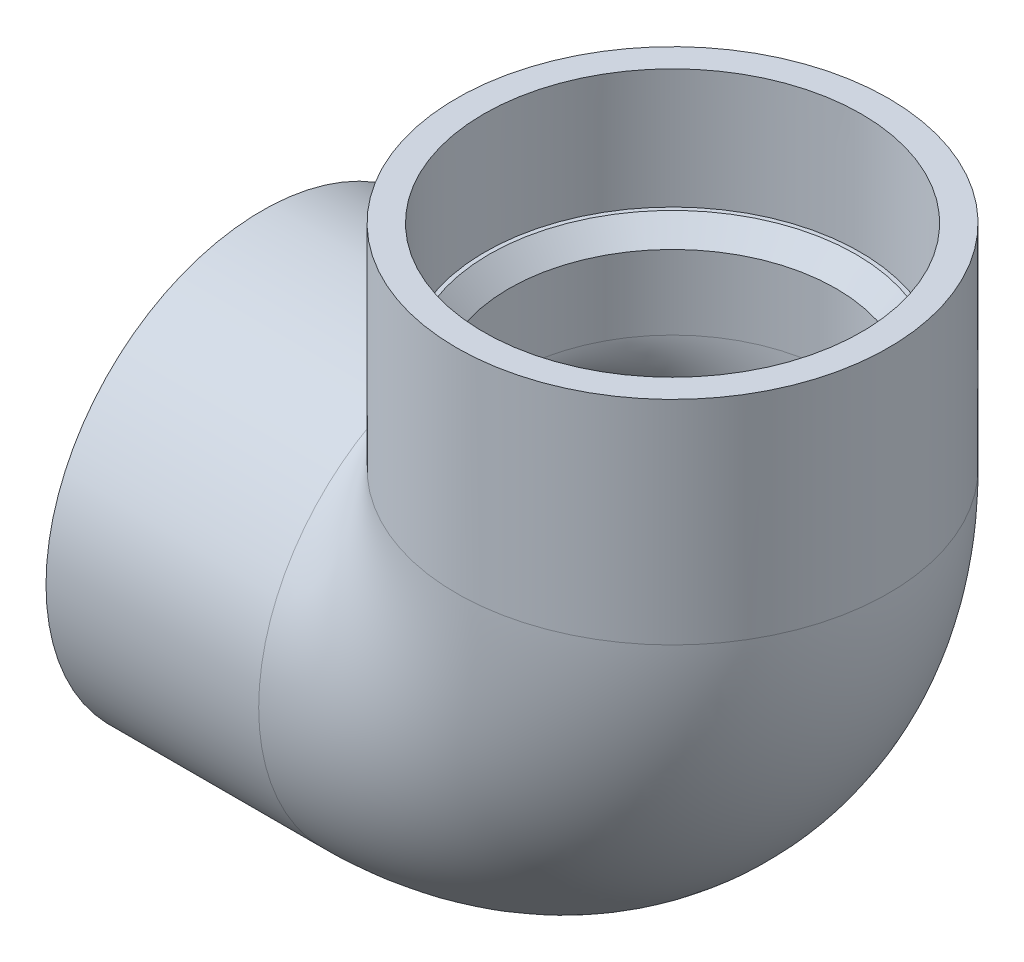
SolidWorks part; units mm, degrees
ref_plane "Front Plane" through (0, 0, 0) normal (0, 0, 1) x (1, 0, 0)
ref_plane "Top Plane" through (0, 0, 0) normal (0, 1, 0) x (1, 0, 0)
ref_plane "Right Plane" through (0, 0, 0) normal (1, 0, 0) x (0, 0, -1)
sketch "Sketch0" plane through (0, 0, 0) normal (0, 0, 1) x (1, 0, 0)
  line L0 (-65.8813, 0) -> (0, 0) construction
  line L1 (0, 0) -> (0, 65.8813) construction
  line L2 (-31.75, 0) -> (0, 0) construction
  line L3 (0, 0) -> (0, 31.75) construction
  line L4 (-65.8812, 34.671) -> (-65.8812, -34.671) construction
  line L5 (-31.75, 30.0863) -> (-65.8812, 30.3149) construction
  line L6 (-31.75, 30.0863) -> (-31.75, -30.0863) construction
  line L7 (-31.75, -30.0863) -> (-65.8812, -30.3149) construction
  line L8 (-65.8812, 30.3149) -> (-65.8812, -30.3149) construction
  line L9 (-34.671, 65.8813) -> (34.671, 65.8813) construction
  line L10 (-30.3149, 65.8813) -> (30.3149, 65.8813) construction
  line L11 (30.3149, 65.8813) -> (30.0863, 31.75) construction
  line L12 (30.0863, 31.75) -> (-30.0863, 31.75) construction
  line L13 (-30.0863, 31.75) -> (-30.3149, 65.8813) construction
  line L14 (-31.75, 26.2509) -> (-31.75, -26.2509) construction
  line L18 (-26.2509, 31.75) -> (26.2509, 31.75) construction
  dimension "H" = 65.8813
  dimension "G" = 31.75
  dimension "M" = 69.342
  dimension "OD A" = 60.6298
  dimension "OD B" = 60.1726
  dimension "ID" = 52.5018
sketch "Sketch1" plane through (0, 0, 0) normal (0, 0, 1) x (1, 0, 0)
  line L0 (-65.8813, 0) -> (0, 0) construction
  line L1 (-65.8813, 0) -> (0, 0) construction
  line L3 (-65.8812, -34.671) -> (-31.75, -34.671)
  line L4 (-65.8812, -34.671) -> (-65.8812, -30.3149)
  line L5 (-65.8812, -30.3149) -> (-31.75, -30.0863)
  line L6 (-31.75, -34.671) -> (-31.75, -30.0863)
revolve "Revolve1" add sketch "Sketch1" angle 360 about L1
sketch "Sketch2" plane through (0, 0, 0) normal (0, 0, 1) x (1, 0, 0)
  line L0 (30.3149, 65.8813) -> (30.0863, 31.75)
  line L1 (30.0863, 31.75) -> (34.671, 31.75)
  line L2 (34.671, 31.75) -> (34.671, 65.8813)
  line L3 (34.671, 65.8813) -> (30.3149, 65.8813)
  line L4 (0, 0) -> (0, 65.8813) construction
  line L5 (0, 0) -> (0, 65.8813) construction
revolve "Revolve2" add sketch "Sketch2" angle 360 about L5
sketch "Sketch3" plane through (-31.75, 0, 0) normal (1, 0, 0) x (0, 0, -1)
  circle A0 centre (0, 0) radius 26.2509
  circle A1 centre (0, 0) radius 34.671
sketch "Sketch4" plane through (0, 0, 0) normal (0, 0, 1) x (1, 0, 0)
  line L0 (-65.8813, 0) -> (0, 0) construction
  line L1 (0, 0) -> (0, 65.8813) construction
  line L2 (-65.8813, 0) -> (-31.75, 0) construction
  line L3 (0, 31.75) -> (0, 65.8813) construction
  arc A0 (-31.75, 0) -> (0, 31.75) centre (-31.75, 31.75) ccw
sweep "Sweep1" add profiles "Sketch3" path "Sketch4"
sketch "Sketch5" plane through (-31.75, 0, 0) normal (-1, 0, 0) x (0, 0, 1)
  circle A0 centre (0, 0) radius 30.0863 construction
  circle A1 centre (0, 0) radius 26.2509 construction
  circle A2 centre (0, 0) radius 30.0863
  circle A3 centre (0, 0) radius 26.2509
extrude "Boss-Extrude1" add sketch "Sketch5" along normal offset from surface (15.0812 mm away) 19.05
sketch "Sketch6" plane through (0, 31.75, 0) normal (0, 1, 0) x (1, 0, 0)
  circle A0 centre (0, 0) radius 26.2509 construction
  circle A1 centre (0, 0) radius 30.0863
  circle A2 centre (0, 0) radius 30.0863
  circle A3 centre (0, 0) radius 26.2509
  dimension "D1" = 0
extrude "Boss-Extrude2" add sketch "Sketch6" along normal offset from surface (15.0812 mm away) 19.05
chamfer "Chamfer1" distance 3.175 angle 45 2 edges at (-46.8312, 0, 26.2509) (0, 46.8313, 26.2509)
